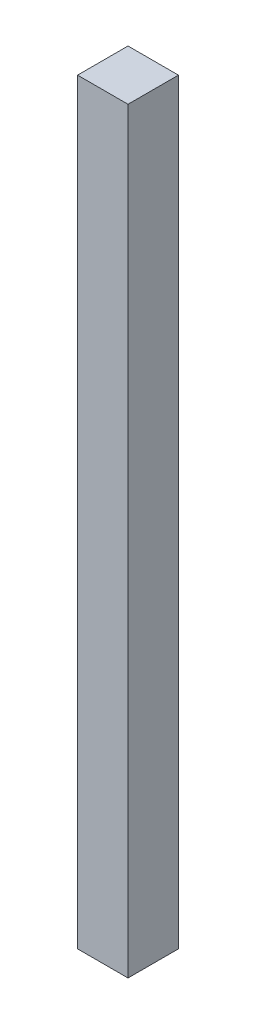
SolidWorks part; units mm, degrees
ref_plane "Front" through (0, 0, 0) normal (0, 0, 1) x (1, 0, 0)
ref_plane "Top" through (0, 0, 0) normal (0, 1, 0) x (1, 0, 0)
ref_plane "Right" through (0, 0, 0) normal (1, 0, 0) x (0, 0, -1)
sketch "Sketch1" plane through (0, 0, 0) normal (0, 1, 0) x (1, 0, 0)
  line L1 (0, 0) -> (10, 0)
  line L2 (0, 0) -> (0, 10)
  line L3 (0, 10) -> (10, 10)
  line L4 (10, 0) -> (10, 10)
  line L5 (5, 10) -> (5, 0) construction
  line L6 (0, 5) -> (10, 5) construction
  point P48 (5, 5)
  dimension "D1" = 10
  dimension "D2" = 10
extrude "Boss-Extrude1" add sketch "Sketch1" against normal blind 150
